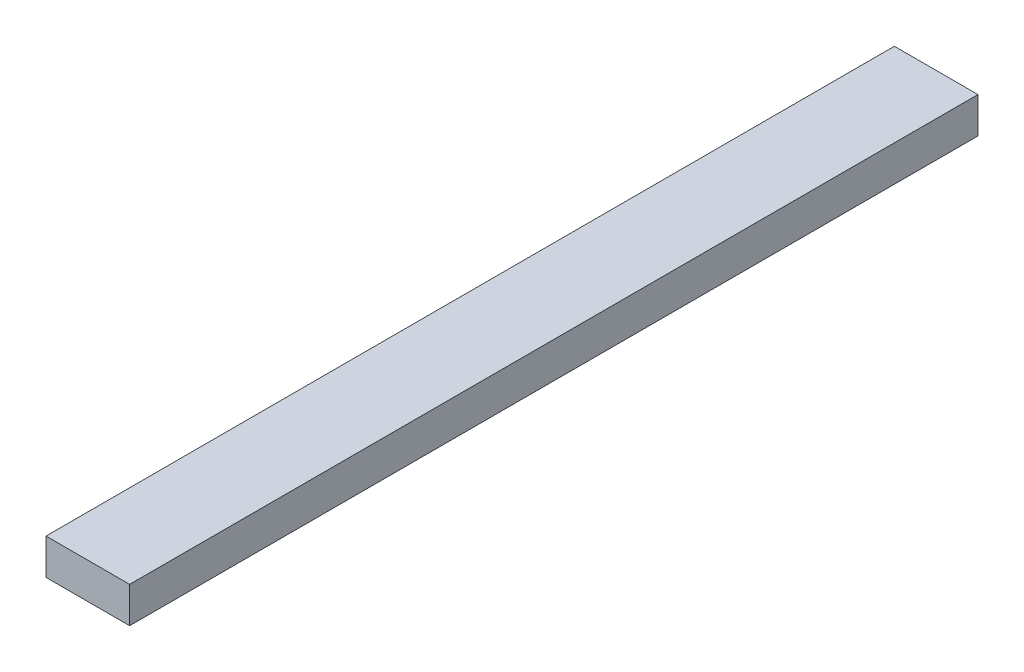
SolidWorks part; units mm, degrees
ref_plane "Front Plane" through (0, 0, 0) normal (0, 0, 1) x (1, 0, 0)
ref_plane "Top Plane" through (0, 0, 0) normal (0, 1, 0) x (1, 0, 0)
ref_plane "Right Plane" through (0, 0, 0) normal (1, 0, 0) x (0, 0, -1)
sketch "Sketch1" plane through (0, 0, 0) normal (0, 1, 0) x (1, 0, 0)
  line L0 (0, 0) -> (0, -901.7)
  line L1 (0, -901.7) -> (-88.9, -901.7)
  line L2 (-88.9, -901.7) -> (-88.9, 0)
  line L3 (-88.9, 0) -> (0, 0)
  dimension "D1" = 901.7
  dimension "D3" = 88.9
extrude "Boss-Extrude1" add sketch "Sketch1" along normal blind 38.1
